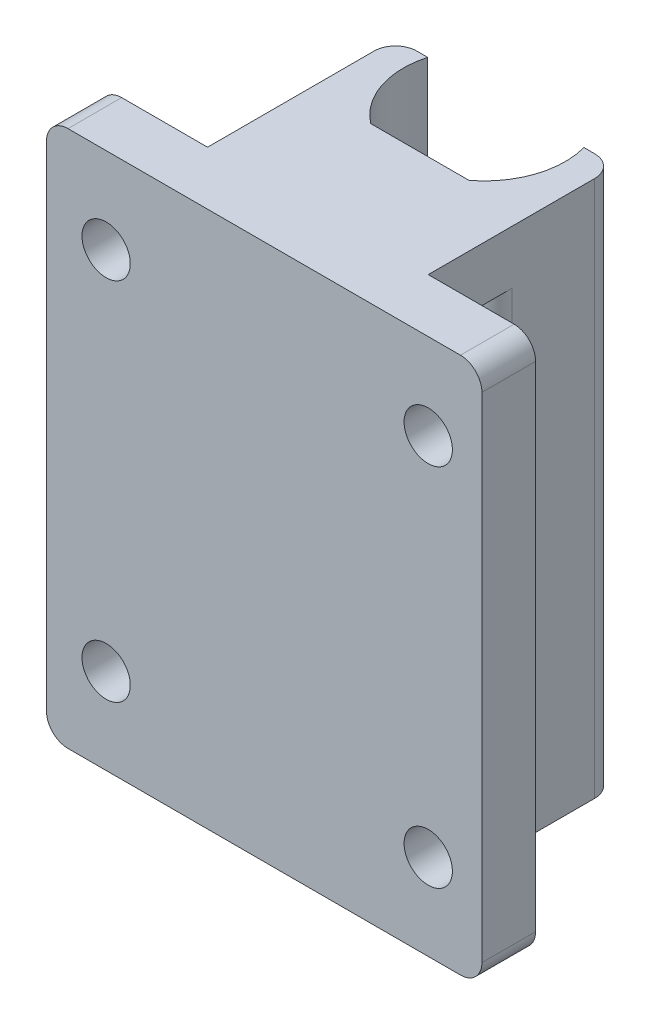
SolidWorks part; units mm, degrees
ref_plane "Front Plane" through (0, 0, 0) normal (0, 0, 1) x (1, 0, 0)
ref_plane "Top Plane" through (0, 0, 0) normal (0, 1, 0) x (1, 0, 0)
ref_plane "Right Plane" through (0, 0, 0) normal (1, 0, 0) x (0, 0, -1)
sketch "Sketch1" plane through (0, 0, 0) normal (0, 1, 0) x (1, 0, 0)
  line L0 (-5.277, 0) -> (35.277, 0)
  line L1 (-5.277, 0) -> (-5.277, 5)
  line L2 (15, 0) -> (15, 27.5) construction
  line L3 (7.723, 22.5) -> (4.723, 22.5)
  line L4 (4.723, 22.5) -> (4.723, 5)
  line L5 (4.723, 5) -> (-5.277, 5)
  line L6 (25.277, 5) -> (35.277, 5)
  line L7 (25.277, 22.5) -> (25.277, 5)
  line L8 (22.277, 22.5) -> (25.277, 22.5)
  line L9 (35.277, 0) -> (35.277, 5)
  arc A0 (22.277, 22.5) -> (7.723, 22.5) centre (15, 20.5) cw
  point P3 (15, 20.5)
  dimension "D1" = 20.5
  dimension "D2" = 10
  dimension "D3" = 2
  dimension "D4" = 5
extrude "Boss-Extrude1" add sketch "Sketch1" along normal blind 50
ref_plane "Plane1" through (0, 0, -14.5) normal (0, 0, -1) x (-1, 0, 0)
sketch "Sketch2" plane through (0, 0, -14.5) normal (0, 0, -1) x (-1, 0, 0)
  line L0 (-7.723, 50) -> (-7.723, 0) construction
  line L1 (-22.277, 50) -> (-7.723, 50)
  line L2 (-22.277, 50) -> (-22.277, 47.5)
  line L3 (-22.277, 47.5) -> (-7.723, 47.5)
  line L4 (-7.723, 50) -> (-7.723, 47.5)
  line L6 (-22.277, 0) -> (-7.723, 0)
  line L7 (-22.277, 0) -> (-22.277, 2.5)
  line L8 (-22.277, 2.5) -> (-7.723, 2.5)
  line L9 (-7.723, 0) -> (-7.723, 2.5)
extrude "Boss-Extrude2" add sketch "Sketch2" against normal blind 10
fillet "Fillet1" radius 2 6 edges at (-5.277, 50, -2.5) (-5.277, 0, -2.5) (35.277, 50, -2.5) (35.277, 0, -2.5) (4.723, 25, -22.5) (25.277, 25, -22.5)
sketch "Sketch3" plane through (0, 0, -5) normal (0, 0, -1) x (-1, 0, 0)
  line L0 (-33.277, 50) -> (-25.277, 50) construction
  line L1 (-35.277, 48) -> (-35.277, 2) construction
  circle A0 centre (-30.277, 42) radius 2.25
  circle A1 centre (-0.277, 42) radius 2.25
  circle A2 centre (-0.277, 8) radius 2.25
  circle A3 centre (-30.277, 8) radius 2.25
  dimension "D1" = 8
  dimension "D2" = 5
  dimension "D3" = 2
  dimension "D4" = 2
extrude "Cut-Extrude1" cut sketch "Sketch3" against normal through all
sketch "Sketch4" plane through (4.723, 0, 0) normal (-1, 0, 0) x (0, 0, 1)
  line L0 (-20.5, 50) -> (-5, 50) construction
  line L1 (-10.8027, 45) -> (-8.8027, 45)
  line L2 (-10.8027, 45) -> (-10.8027, 40)
  line L3 (-10.8027, 40) -> (-8.8027, 40)
  line L4 (-8.8027, 45) -> (-8.8027, 40)
  line L5 (-10.8027, 10) -> (-8.8027, 10)
  line L6 (-10.8027, 10) -> (-10.8027, 5)
  line L7 (-10.8027, 5) -> (-8.8027, 5)
  line L8 (-8.8027, 10) -> (-8.8027, 5)
  dimension "D1" = 5
  dimension "D2" = 2
extrude "Cut-Extrude2" cut sketch "Sketch4" against normal through all
fillet "Fillet2" radius 2 4 edges at (4.723, 42.5, -10.8027) (4.723, 7.5, -10.8027) (25.277, 7.5, -10.8027) (25.277, 42.5, -10.8027)
